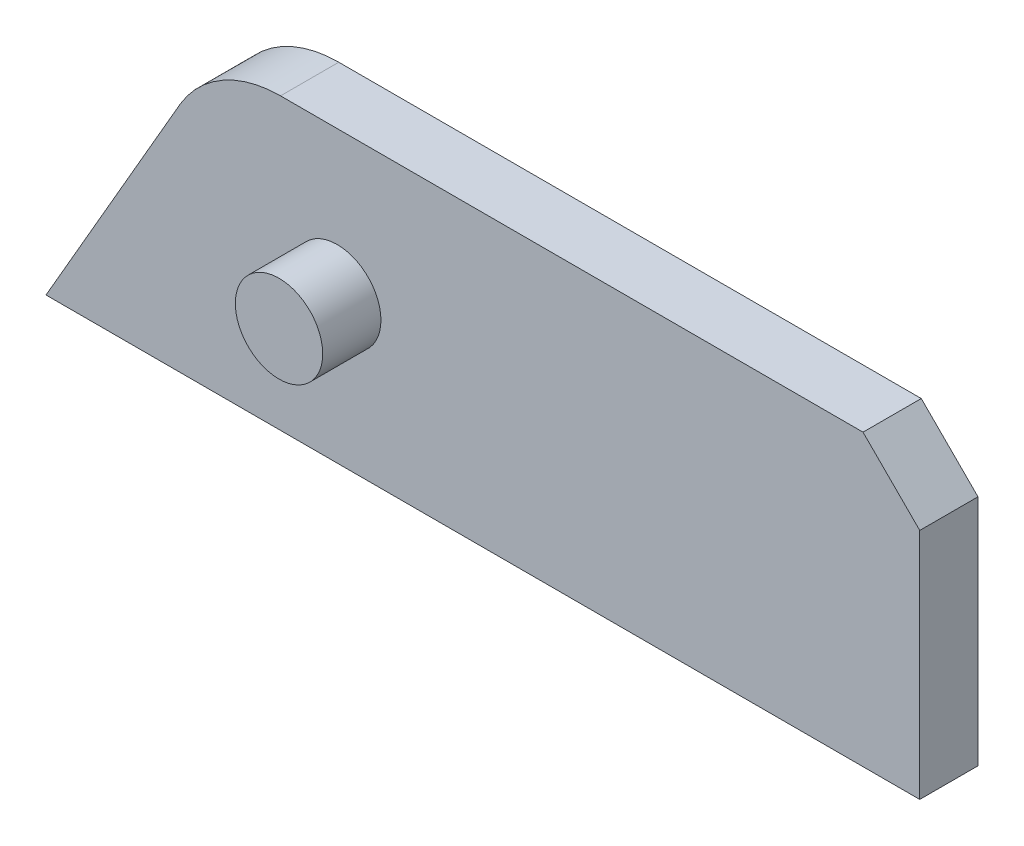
SolidWorks part; units mm, degrees
ref_plane "Front Plane" through (0, 0, 0) normal (0, 0, 1) x (1, 0, 0)
ref_plane "Top Plane" through (0, 0, 0) normal (0, 1, 0) x (1, 0, 0)
ref_plane "Right Plane" through (0, 0, 0) normal (1, 0, 0) x (0, 0, -1)
sketch "Sketch3" plane through (0, 0, 0) normal (0, 0, 1) x (1, 0, 0)
  line L0 (0, 0) -> (0, 40)
  line L1 (0, 40) -> (-9.7389, 49.7389)
  line L2 (-9.7389, 49.7389) -> (-109.7389, 49.7389)
  line L3 (-126.906, 40) -> (-150, 0)
  line L4 (-150, 0) -> (0, 0)
  line L5 (-118.2901, 34.9232) -> (-132.6795, 10)
  line L6 (-132.6795, 10) -> (-10, 10)
  line L7 (-10, 10) -> (-10, 35.8579)
  line L8 (-10, 35.8579) -> (-13.881, 39.7389)
  line L9 (-13.881, 39.7389) -> (-109.7389, 39.7389)
  arc A0 (-109.7389, 49.7389) -> (-126.906, 40) centre (-109.7389, 29.7389) ccw
  arc A1 (-109.7389, 39.7389) -> (-118.2901, 34.9232) centre (-109.7389, 29.7389) ccw
  dimension "D3" = 20
  dimension "D1" = 150
  dimension "D2" = 60
  dimension "D4" = 100
  dimension "D5" = 40
  dimension "D6" = 135
  dimension "D7" = 10
extrude "Boss-Extrude1" add sketch "Sketch3" along normal blind 10 contours L4 L0 L1 L2 A0 L3
sketch "Sketch4" plane through (0, 0, 10) normal (0, 0, 1) x (1, 0, 0)
  line L0 (-150, 0) -> (0, 0) construction
  circle A0 centre (-100, 25) radius 7.5
  dimension "D3" = 15
  dimension "D1" = 25
  dimension "D2" = 100
extrude "Boss-Extrude2" add sketch "Sketch4" along normal blind 10
